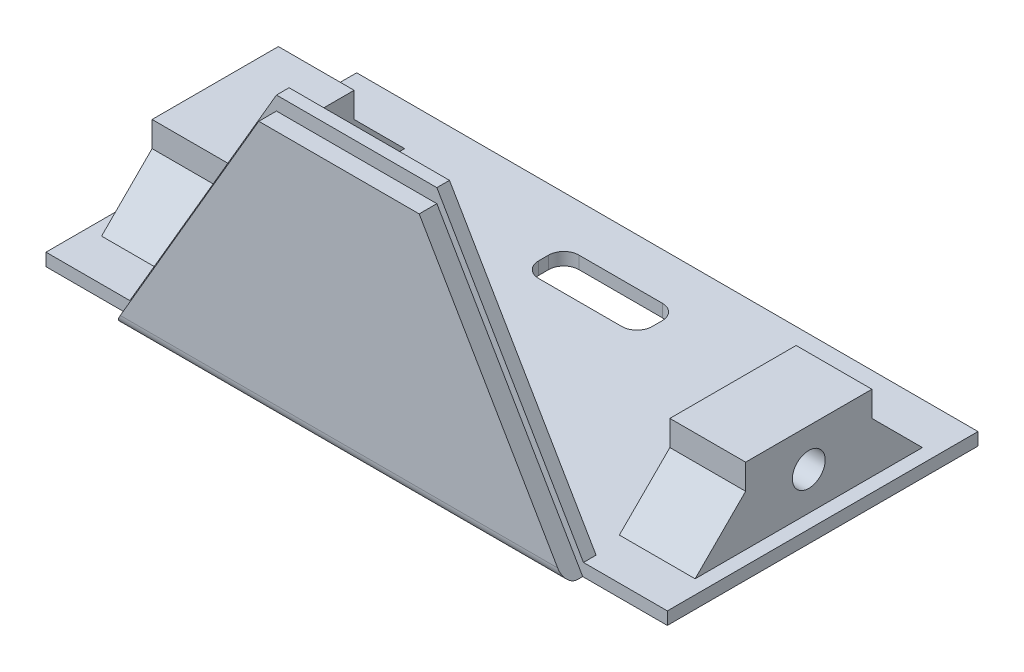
SolidWorks part; units mm, degrees
ref_plane "Ebene vorne" through (0, 0, 0) normal (0, 0, 1) x (1, 0, 0)
ref_plane "Ebene oben" through (0, 0, 0) normal (0, 1, 0) x (1, 0, 0)
ref_plane "Ebene rechts" through (0, 0, 0) normal (1, 0, 0) x (0, 0, -1)
sketch "Skizze1" plane through (0, 0, 0) normal (0, 1, 0) x (1, 0, 0)
  line L1 (24.6, 12.3) -> (-24.6, 12.3)
  line L2 (24.6, 12.3) -> (24.6, -12.3)
  line L3 (24.6, -12.3) -> (-24.6, -12.3)
  line L4 (-24.6, 12.3) -> (-24.6, -12.3)
  line L5 (24.6, 12.3) -> (-24.6, -12.3) construction
  line L6 (24.6, -12.3) -> (-24.6, 12.3) construction
  point P0 (0, 0)
  dimension "D1" = 24.6
  dimension "D2" = 49.2
extrude "Aufsatz-Linear austragen1" add sketch "Skizze1" along normal blind 1
sketch "Skizze2" plane through (0, 0, 12.3) normal (0, 0, 1) x (1, 0, 0)
  line L0 (0, 0) -> (0, 23.7746) construction
  line L1 (-24.6, 0) -> (24.6, 0) construction
  line L2 (17.9, 0) -> (-17.9, 0)
  line L3 (17.9, 0) -> (6.35, 19.8)
  line L4 (-17.9, 0) -> (-6.35, 19.8)
  line L5 (-6.35, 19.8) -> (6.35, 19.8)
  point P9 (0, 19.8)
  dimension "D1" = 17.9
  dimension "D3" = 19.8
  dimension "D4" = 6.35
extrude "Aufsatz-Linear austragen2" add sketch "Skizze2" along normal blind 1.4
sketch "Skizze4" plane through (0, 0, 12.3) normal (0, 0, -1) x (-1, 0, 0)
  line L0 (17.3167, 1) -> (-17.3167, 1) construction
  line L2 (-6.35, 19.8) -> (6.35, 19.8) construction
  line L3 (6.35, 19.8) -> (17.3167, 1) construction
  line L4 (6.35, 19.8) -> (6.35, 20.9) construction
  line L5 (6.35, 20.9) -> (17.9583, 1)
  line L6 (24.6, 1) -> (17.3167, 1) construction
  line L7 (0, 0) -> (0, 22.2284) construction
  line L8 (6.35, 20.9) -> (-6.35, 20.9)
  line L9 (17.9583, 1) -> (-17.9583, 1)
  line L10 (-6.35, 19.8) -> (-6.35, 20.9) construction
  line L11 (-6.35, 19.8) -> (-17.3167, 1) construction
  line L12 (-6.35, 20.9) -> (-17.9583, 1)
  point P17 (0, 20.9)
  point P19 (0, 19.8)
  point P20 (0, 1)
  dimension "D1" = 1.1
extrude "Aufsatz-Linear austragen3" add sketch "Skizze4" along normal blind 1
ref_plane "Ebene1" through (5, 0, 0) normal (1, 0, 0) x (0, 0, -1)
sketch "Skizze5" plane through (5, 0, 0) normal (1, 0, 0) x (0, 0, -1)
  line L0 (-6.3, 1) -> (-11.3, 15.9)
  line L1 (-12.3, 1) -> (12.3, 1) construction
  line L2 (-11.3, 20.9) -> (-11.3, 1) construction
  line L3 (-11.3, 20.9) -> (-12.3, 20.9) construction
  line L4 (-11.3, 15.9) -> (-11.3, 1)
  line L5 (-11.3, 1) -> (-6.3, 1)
  dimension "D1" = 5
  dimension "D2" = 5
extrude "Aufsatz-Linear austragen4" add sketch "Skizze5" along normal blind 0.5 and the other way blind 0.5
mirror "Spiegeln1" about plane through (0, 0, 0) normal (1, 0, 0) of "Aufsatz-Linear austragen4"
sketch "Skizze6" plane through (0, 1, 0) normal (0, 1, 0) x (1, 0, 0)
  line L0 (0, 0) -> (-23.3324, 0) construction
  line L1 (-24.6, 12.3) -> (-24.6, -12.3) construction
  line L2 (-17.5, 5) -> (-23.5, 5)
  line L3 (-17.5, 5) -> (-17.5, -5)
  line L4 (-17.5, -5) -> (-23.5, -5)
  line L5 (-23.5, 5) -> (-23.5, -5)
  line L6 (-17.5, 5) -> (-23.5, -5) construction
  line L7 (-17.5, -5) -> (-23.5, 5) construction
  point P3 (-20.5, 0)
  dimension "D1" = 10
  dimension "D2" = 6
  dimension "D3" = 1.1
extrude "Aufsatz-Linear austragen5" add sketch "Skizze6" along normal blind 6
sketch "Skizze7" plane through (-23.5, 0, 0) normal (-1, 0, 0) x (0, 0, 1)
  line L0 (-12.3, 1) -> (12.3, 1) construction
  line L1 (0, 0) -> (0, 4) construction
  circle A0 centre (0, 4) radius 1.3
  circle A1 centre (0, 4) radius 3 construction
  dimension "D1" = 2.6
  dimension "D2" = 3
extrude "Schnitt-Linear austragen1" cut sketch "Skizze7" against normal up to surface (6 mm away)
chamfer "Fase1" distance 4 angle 45 2 edges at (-20.5, 1, -5) (-20.5, 1, 5)
mirror "Spiegeln2" about plane through (0, 0, 0) normal (1, 0, 0) of "Fase1", "Aufsatz-Linear austragen5", "Schnitt-Linear austragen1"
fillet "Verrundung1" radius 1 1 edges at (0, 0, 13.7)
sketch "Skizze8" plane through (0, 0, 0) normal (0, -1, 0) x (1, 0, 0)
  line L0 (0, 0) -> (0, -7) construction
  line L1 (24.6, -12.3) -> (-24.6, -12.3) construction
  line L2 (3.3, -5.4) -> (-3.3, -5.4)
  line L3 (4.5, -6.6) -> (4.5, -7.4)
  line L4 (3.3, -8.6) -> (-3.3, -8.6)
  line L5 (-4.5, -6.6) -> (-4.5, -7.4)
  line L6 (4.5, -5.4) -> (-4.5, -8.6) construction
  line L7 (4.5, -8.6) -> (-4.5, -5.4) construction
  arc A0 (4.5, -7.4) -> (3.3, -8.6) centre (3.3, -7.4) cw
  arc A1 (-3.3, -8.6) -> (-4.5, -7.4) centre (-3.3, -7.4) cw
  arc A2 (3.3, -5.4) -> (4.5, -6.6) centre (3.3, -6.6) cw
  arc A3 (-3.3, -5.4) -> (-4.5, -6.6) centre (-3.3, -6.6) ccw
  dimension "D3" = 1.2
  dimension "D1" = 9
  dimension "D2" = 3.2
  dimension "D4" = 3.7
extrude "Schnitt-Linear austragen2" cut sketch "Skizze8" against normal up to surface (1 mm away)
